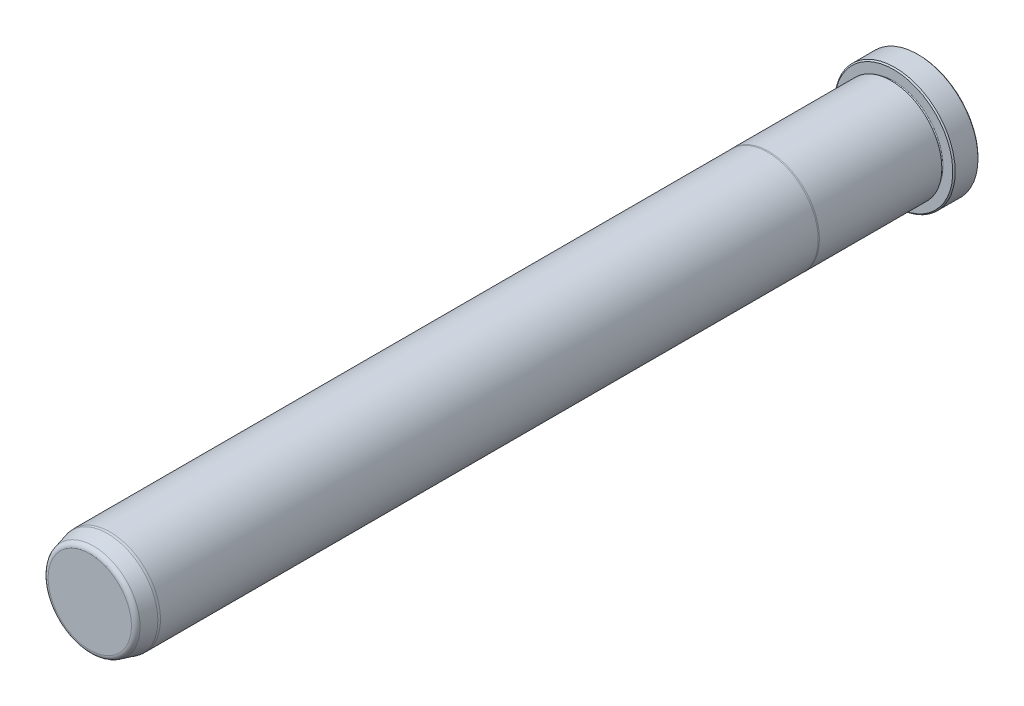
SolidWorks part; units mm, degrees
ref_plane "Front Plane" through (0, 0, 0) normal (0, 0, 1) x (1, 0, 0)
ref_plane "Top Plane" through (0, 0, 0) normal (0, 1, 0) x (1, 0, 0)
ref_plane "Right Plane" through (0, 0, 0) normal (1, 0, 0) x (0, 0, -1)
sketch "Sketch1" plane through (0, 0, 0) normal (1, 0, 0) x (0, 0, -1)
  line L0 (0, 0) -> (0, 18.923)
  line L1 (0, 18.923) -> (-7.9248, 18.923)
  line L2 (-7.9248, 18.923) -> (-7.9248, 15.4813)
  line L3 (-4.7498, 15.1003) -> (-5.5118, 15.1003) construction
  line L4 (-8.6868, 15.4813) -> (-8.6868, 15.8877)
  line L5 (-8.6868, 15.8877) -> (-47.1348, 15.8877)
  line L6 (-47.1348, 15.8877) -> (-47.498, 15.8623)
  line L7 (-47.498, 15.8623) -> (-254, 15.8623)
  line L9 (-260.35, 14.2983) -> (-260.35, 0)
  line L10 (-260.35, 0) -> (0, 0)
  line L11 (0, 0) -> (13.6287, 0) construction
  line L12 (-254, 15.8623) -> (-254.762, 15.7956)
  line L13 (-254.762, 15.7956) -> (-260.35, 14.2983)
  arc A0 (-8.6868, 15.4813) -> (-7.9248, 15.4813) centre (-8.3058, 15.4813) ccw
  dimension "D14" = 0.762
  dimension "D1" = 7.9248
  dimension "D2" = 0.762
  dimension "D3" = 37.846
  dimension "D4" = 31.7754
  dimension "D5" = 47.498
  dimension "D6" = 260.35
  dimension "D7" = 0.7874
  dimension "D8" = 4
  dimension "D9" = 31.7246
  dimension "D10" = 5
  dimension "D11" = 15
  dimension "D12" = 0.762
  dimension "D13" = 6.35
revolve "Revolve1" add sketch "Sketch1" angle 360 about L11
fillet "Fillet6" radius 1.5875 1 edges at (14.2983, 0, 260.35)
chamfer "Chamfer1" distance 0.381 angle 45 2 edges at (18.923, 0, 0) (18.923, 0, 7.9248)
